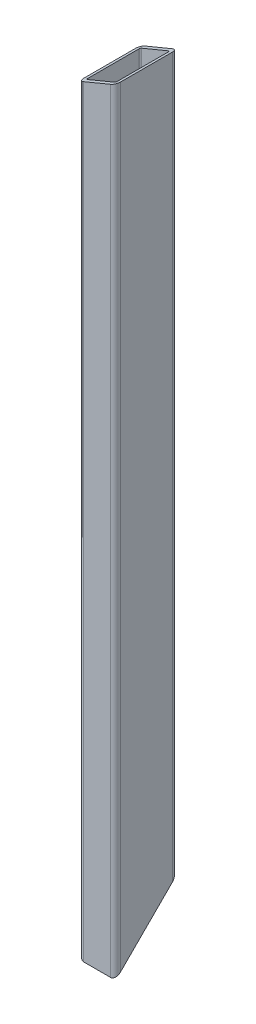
SolidWorks part; units mm, degrees
ref_plane "Plan de face" through (0, 0, 0) normal (0, 0, 1) x (1, 0, 0)
ref_plane "Plan de dessus" through (0, 0, 0) normal (0, 1, 0) x (1, 0, 0)
ref_plane "Plan de droite" through (0, 0, 0) normal (1, 0, 0) x (0, 0, -1)
imported_body "Importée3"
fillet "Congé1" radius 1
fillet "Congé2" radius 4 4 edges at (15, 314.4, 25) (-15, 333.1868, -25) (15, 339.4, -25) (-15, 308.1868, 25)
